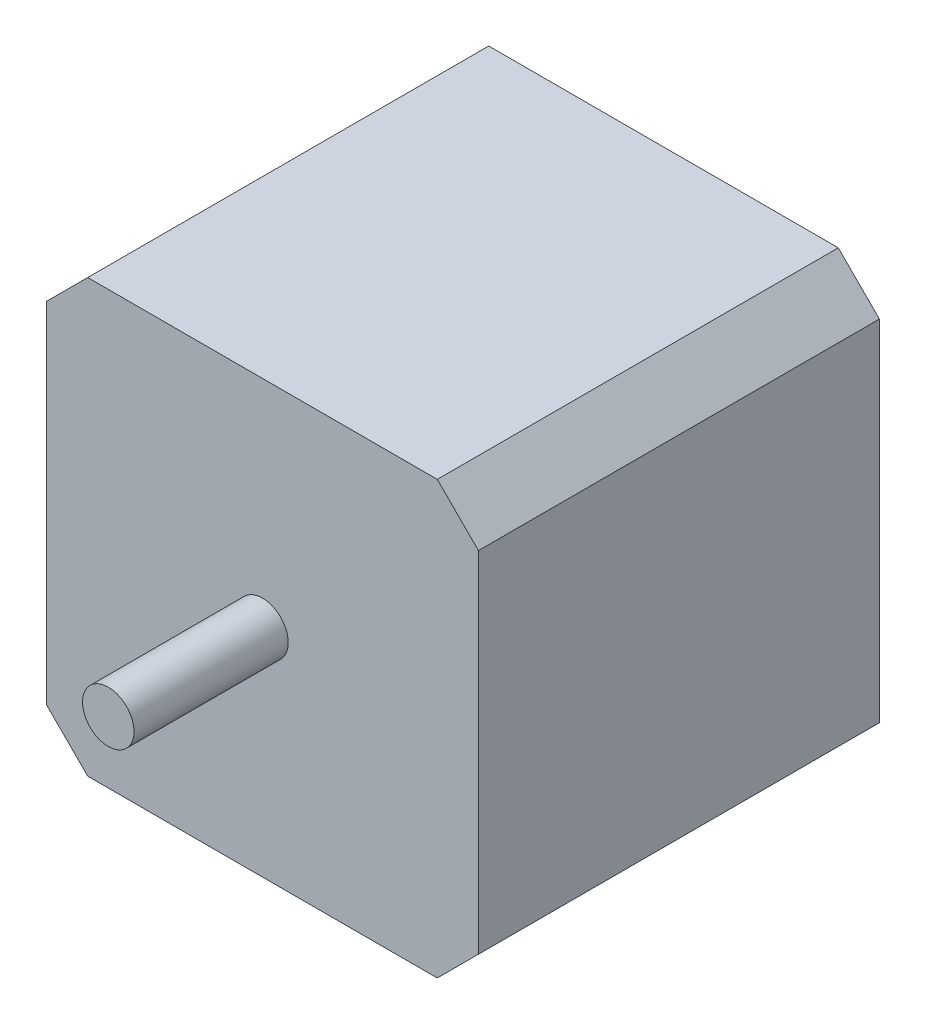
SolidWorks part; units mm, degrees
ref_plane "Plan de face" through (0, 0, 0) normal (0, 0, 1) x (1, 0, 0)
ref_plane "Plan de dessus" through (0, 0, 0) normal (0, 1, 0) x (1, 0, 0)
ref_plane "Plan de droite" through (0, 0, 0) normal (1, 0, 0) x (0, 0, -1)
sketch "Esquisse1" plane through (0, 0, 0) normal (0, 0, 1) x (1, 0, 0)
  line L1 (0, 0) -> (42, 0)
  line L2 (0, 0) -> (0, 42)
  line L3 (0, 42) -> (42, 42)
  line L4 (42, 0) -> (42, 42)
  dimension "D1" = 42
  dimension "D2" = 42
extrude "Boss.-Extru.1" add sketch "Esquisse1" along normal blind 39
sketch "Esquisse3" plane through (0, 0, 39) normal (0, 0, 1) x (1, 0, 0)
  circle A0 centre (21, 21) radius 2.5
  dimension "D1" = 5
extrude "Boss.-Extru.2" add sketch "Esquisse3" along normal blind 15
chamfer "Chanfrein1" distance 4 angle 45 4 edges at (42, 0, 19.5) (0, 0, 19.5) (0, 42, 19.5) (42, 42, 19.5)
